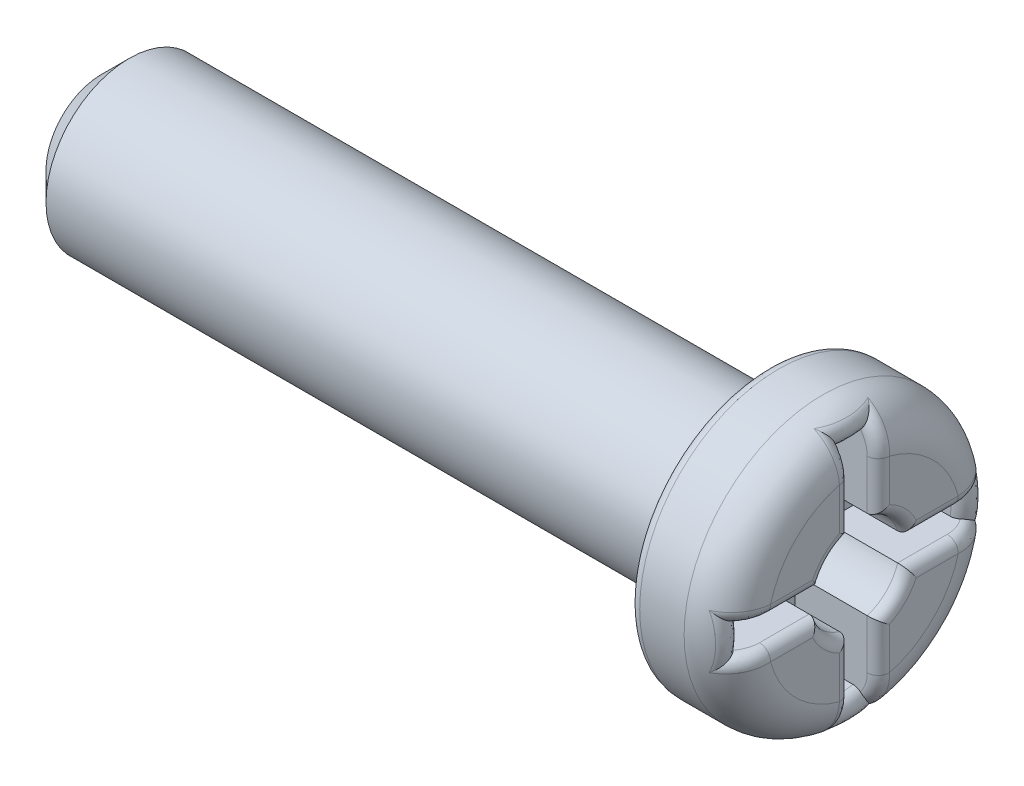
SolidWorks part; units mm, degrees
ref_plane "Face" through (0, 0, 0) normal (0, 0, 1) x (1, 0, 0)
ref_plane "Dessus" through (0, 0, 0) normal (0, 1, 0) x (1, 0, 0)
ref_plane "Droite" through (0, 0, 0) normal (1, 0, 0) x (0, 0, -1)
sketch "Esquisse1" plane through (0, 0, 0) normal (0, 0, 1) x (1, 0, 0)
  line L0 (0, 0) -> (5, 0) construction
  line L1 (0, 0) -> (0, 1.5)
  line L2 (0, 1.5) -> (12, 1.5)
  line L3 (12, 1.5) -> (12, 2.5)
  line L4 (12, 2.5) -> (13, 2.5)
  line L5 (13.75, 1.75) -> (13.75, 0)
  line L6 (0, 0) -> (13.75, 0)
  arc A0 (13, 2.5) -> (13.75, 1.75) centre (13, 1.75) cw
  point P10 (13.75, 2.5)
  dimension "D5" = 0.75
  dimension "D1" = 3
  dimension "D2" = 12
  dimension "D3" = 1.75
  dimension "D4" = 5
revolve "Révolution1" add sketch "Esquisse1" angle 360 about L0
sketch "Esquisse2" plane through (13.75, 0, 0) normal (1, 0, 0) x (0, 0, -1)
  line L0 (0, 0) -> (0, 2.6874) construction
  line L1 (0.25, 0) -> (-0.25, 0)
  line L2 (-0.25, 0) -> (-0.25, 2)
  line L3 (0.25, 0) -> (0.25, 2)
  line L4 (-0.25, 2) -> (0.25, 2)
  point P8 (0, 2)
  dimension "D1" = 0.5
  dimension "D2" = 2
extrude "Enlèv. mat.-Extru.1" cut sketch "Esquisse2" against normal blind 1.5
pattern_circular "Répétition circulaire1" count 4 over 360 about axis through (0, 0, 0) along (1, 0, 0)
sketch "Esquisse3" plane through (13.75, 0, 0) normal (1, 0, 0) x (0, 0, -1)
  circle A0 centre (0, 0) radius 0.8365
extrude "Enlèv. mat.-Extru.2" cut sketch "Esquisse3" against normal up to surface (1.5 mm away)
fillet "Congé2" radius 0.2
chamfer "Chanfrein1" distance 0.5 angle 45
